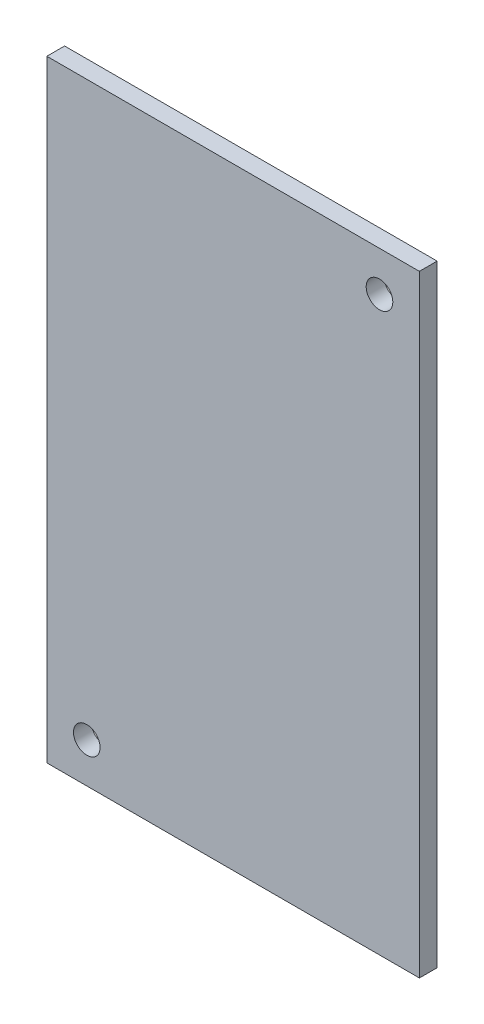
SolidWorks part; units mm, degrees
ref_plane "Alzado" through (0, 0, 0) normal (0, 0, 1) x (1, 0, 0)
ref_plane "Planta" through (0, 0, 0) normal (0, 1, 0) x (1, 0, 0)
ref_plane "Vista lateral" through (0, 0, 0) normal (1, 0, 0) x (0, 0, -1)
sketch "Croquis2" plane through (0, 0, 59.1926) normal (0, 0, 1) x (1, 0, 0)
  line L0 (75.4526, 63.6048) -> (75.4526, 98.1048) construction
  line L1 (54.4526, 98.1048) -> (96.4526, 98.1048)
  line L2 (54.4526, 98.1048) -> (54.4526, 29.1048)
  line L5 (54.4526, 29.1048) -> (96.4526, 29.1048)
  line L6 (96.4526, 98.1048) -> (96.4526, 29.1048)
  line L7 (54.4526, 98.1048) -> (96.4526, 29.1048) construction
  line L8 (54.4526, 29.1048) -> (96.4526, 98.1048) construction
  circle A4 centre (58.9526, 33.6048) radius 1.5
  circle A5 centre (91.9526, 93.6048) radius 1.5
  point P0 (75.4526, 63.6048)
  point P5 (0, 0)
  dimension "D3" = 4.5
  dimension "D1" = 42
  dimension "D2" = 69
  dimension "D4" = 4.5
extrude "Saliente-Extruir1" add sketch "Croquis2" along normal blind 2
